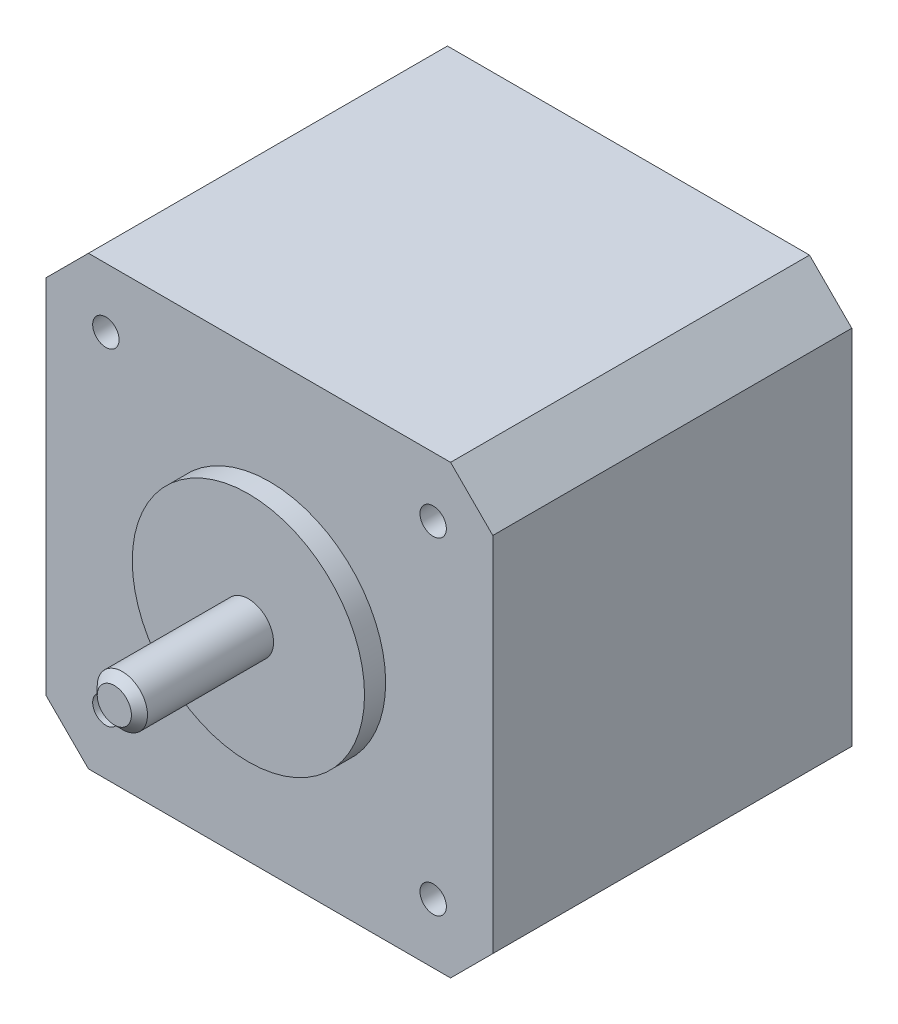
SolidWorks part; units mm, degrees
ref_plane "Front Plane" through (0, 0, 0) normal (0, 0, 1) x (1, 0, 0)
ref_plane "Top Plane" through (0, 0, 0) normal (0, 1, 0) x (1, 0, 0)
ref_plane "Right Plane" through (0, 0, 0) normal (1, 0, 0) x (0, 0, -1)
sketch "Sketch1" plane through (0, 0, 0) normal (0, 0, 1) x (1, 0, 0)
  line L1 (-21.15, -21.15) -> (21.15, -21.15)
  line L2 (-21.15, -21.15) -> (-21.15, 21.15)
  line L3 (-21.15, 21.15) -> (21.15, 21.15)
  line L4 (21.15, -21.15) -> (21.15, 21.15)
  line L5 (-21.15, -21.15) -> (21.15, 21.15) construction
  line L6 (-21.15, 21.15) -> (21.15, -21.15) construction
  point P0 (0, 0)
  dimension "D1" = 42.3
  dimension "D2" = 42.3
extrude "Boss-Extrude1" add sketch "Sketch1" along normal blind 34
chamfer "Chamfer1" distance 4 angle 45 4 edges at (-21.15, -21.15, 17) (21.15, -21.15, 17) (-21.15, 21.15, 17) (21.15, 21.15, 17)
sketch "Sketch2" plane through (0, 0, 34) normal (0, 0, 1) x (1, 0, 0)
  circle A0 centre (0, 0) radius 11
  dimension "D1" = 22
extrude "Boss-Extrude2" add sketch "Sketch2" along normal blind 2
sketch "Sketch3" plane through (0, 0, 36) normal (0, 0, 1) x (1, 0, 0)
  circle A0 centre (0, 0) radius 2.3813
  dimension "D1" = 4.7625
extrude "Boss-Extrude3" add sketch "Sketch3" along normal blind 12.7
sketch "Sketch4" plane through (0, 0, 34) normal (0, 0, 1) x (1, 0, 0)
  line L0 (0, 21.15) -> (0, -21.15) construction
  line L1 (17.15, 21.15) -> (-17.15, 21.15) construction
  line L2 (-17.15, -21.15) -> (17.15, -21.15) construction
  line L3 (21.15, 0) -> (-21.15, 0) construction
  line L4 (21.15, -17.15) -> (21.15, 17.15) construction
  line L5 (-21.15, 17.15) -> (-21.15, -17.15) construction
  circle A0 centre (-15.5, 15.5) radius 1.25
  circle A1 centre (15.5, 15.5) radius 1.25
  circle A2 centre (15.5, -15.5) radius 1.25
  circle A3 centre (-15.5, -15.5) radius 1.25
  dimension "D1" = 2.5
  dimension "D2" = 31
  dimension "D3" = 31
extrude "Cut-Extrude1" cut sketch "Sketch4" against normal blind 4.5
chamfer "Chamfer2" distance 0.762 angle 45 1 edges at (2.3813, 0, 48.7)
